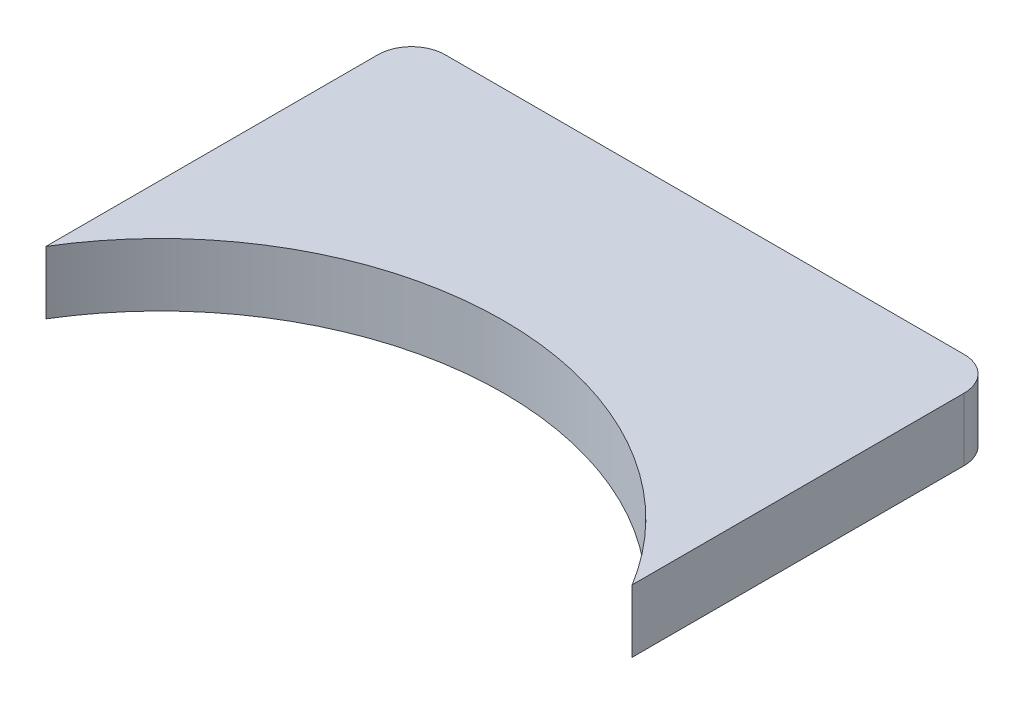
SolidWorks part; units mm, degrees
ref_plane "Front Plane" through (0, 0, 0) normal (0, 0, 1) x (1, 0, 0)
ref_plane "Top Plane" through (0, 0, 0) normal (0, 1, 0) x (1, 0, 0)
ref_plane "Right Plane" through (0, 0, 0) normal (1, 0, 0) x (0, 0, -1)
sketch "Sketch1" plane through (0, 0, 0) normal (0, 1, 0) x (1, 0, 0)
  line L0 (-44.45, -10.9802) -> (-44.45, 39.37)
  line L1 (44.45, -44.45) -> (-44.45, -44.45) construction
  line L2 (44.45, -44.45) -> (44.45, -10.9802) construction
  line L3 (39.37, 44.45) -> (-39.37, 44.45)
  line L4 (-44.45, -44.45) -> (-44.45, -10.9802) construction
  line L5 (44.45, -44.45) -> (-44.45, 44.45) construction
  line L6 (44.45, 44.45) -> (-44.45, -44.45) construction
  line L7 (44.45, -10.9802) -> (44.45, 39.37)
  circle A0 centre (0, -38.1) radius 52.07 construction
  arc A1 (-44.45, -10.9802) -> (44.45, -10.9802) centre (0, -38.1) cw
  arc A2 (44.45, 39.37) -> (39.37, 44.45) centre (39.37, 39.37) ccw
  arc A3 (-39.37, 44.45) -> (-44.45, 39.37) centre (-39.37, 39.37) ccw
  point P0 (0, 0)
  dimension "D3" = 104.14
  dimension "D5" = 5.08
  dimension "D1" = 88.9
  dimension "D2" = 88.9
  dimension "D4" = 6.35
extrude "Boss-Extrude1" add sketch "Sketch1" along normal blind 9.525
